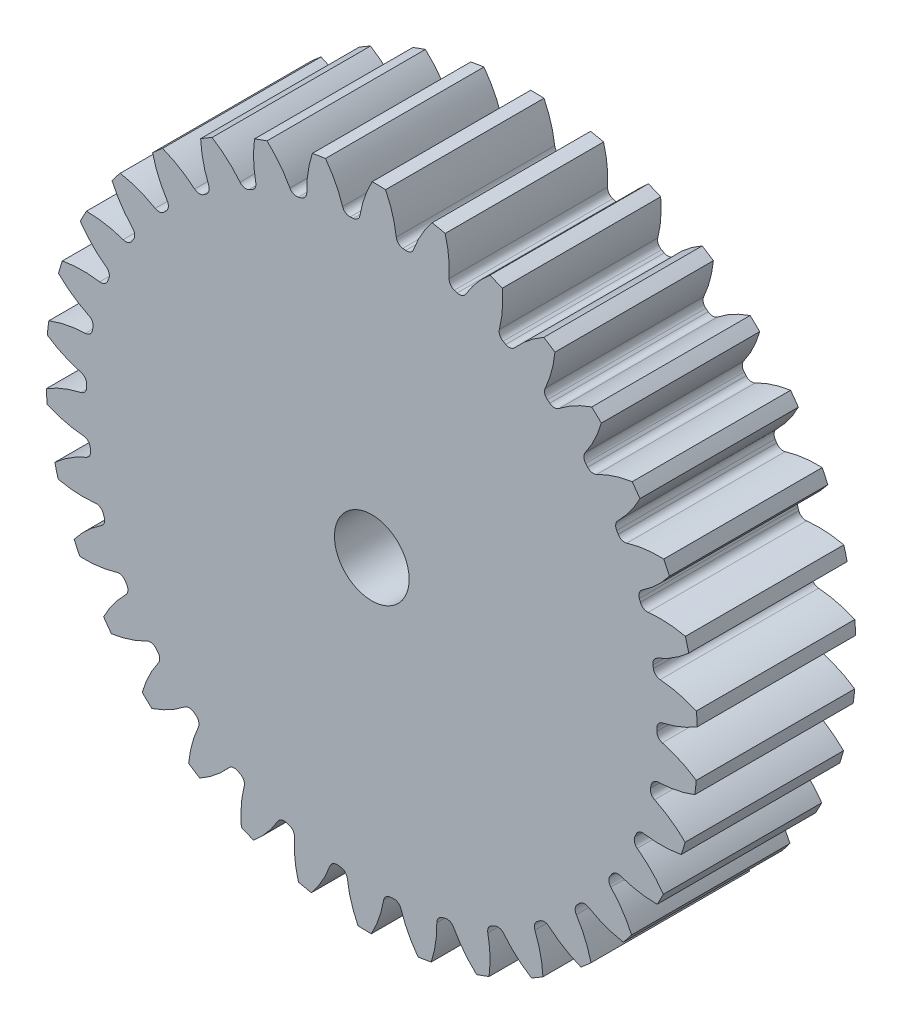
SolidWorks part; units mm, degrees
ref_plane "Front" through (0, 0, 0) normal (0, 0, 1) x (1, 0, 0)
ref_plane "Top" through (0, 0, 0) normal (0, 1, 0) x (1, 0, 0)
ref_plane "Right" through (0, 0, 0) normal (1, 0, 0) x (0, 0, -1)
sketch "Sketch3" plane through (0, 0, 0) normal (0, 0, 1) x (1, 0, 0)
  circle A0 centre (0, 0) radius 182.88
  dimension "od" = 365.76
extrude "gearBody" add sketch "Sketch3" along normal blind 88.9
sketch "Sketch2" plane through (0, 0, 0) normal (0, 0, 1) x (1, 0, 0)
  line L0 (0, 0) -> (149.9491, 62.1109) construction
  line L1 (182.2985, -17.2904) -> (0, 0) construction
  line L2 (0, 0) -> (36.3143, 0) construction
  line L3 (172.6695, 4.1759) -> (172.3221, -11.7178) construction
  line L5 (172.4958, -3.7709) -> (0, 0) construction
  line L7 (0, 0) -> (162.3037, 0) construction
  arc A0 (162.2999, 1.118) -> (162.0959, -8.2096) centre (0, 0) ccw construction
  arc A1 (182.6502, 9.1646) -> (182.0752, -17.1379) centre (0, 0) ccw construction
  arc A2 (172.6695, 4.1759) -> (172.3221, -11.7178) centre (0, 0) ccw construction
  arc A3 (159.9611, -4.3415) -> (159.998, -2.6532) centre (0, 0) ccw
  arc A4 (182.2985, -17.2904) -> (163.0353, -8.4508) centre (147.0915, -68.6046) ccw
  arc A5 (182.2985, -17.2904) -> (182.88, 9.3072) centre (0, 0) ccw
  arc A6 (182.88, 9.3072) -> (163.2488, 1.3178) centre (149.9491, 62.1109) cw
  arc A7 (159.998, -2.6532) -> (163.2488, 1.3178) centre (164.1326, -2.7217) cw
  arc A8 (163.0353, -8.4508) -> (159.9611, -4.3415) centre (164.0947, -4.4537) cw
  point P6 (182.88, 9.3072)
  point P22 (182.2985, -17.2904)
  dimension "baseDia" = 324.6074
  dimension "od" = 365.76
  dimension "pd" = 345.44
  dimension "rd" = 320.04
  dimension "rFillet" = 4.1351
  dimension "pointX" = 182.88
  dimension "pointY" = 9.3072
  dimension "CTT" = 15.8937
  dimension "flankCenterAngle" = 22.5
extrude "toothCut" cut sketch "Sketch2" along normal through all
pattern_circular "CirPattern1" count 34 over 360 about axis through (0, 0, 0) along (0, 0, 1) of "toothCut"
sketch "hub1Dia" plane through (0, 0, 0) normal (0, 0, -1) x (-1, 0, 0)
  circle A0 centre (0, 0) radius 12.7
  dimension "hub1Dia" = 25.4
sketch "hub2Dia" plane through (0, 0, 88.9) normal (0, 0, 1) x (1, 0, 0)
  circle A0 centre (0, 0) radius 12.7
  dimension "hub2dia" = 25.4
sketch "boreDia" plane through (0, 0, 0) normal (0, 0, 1) x (1, 0, 0)
  circle A0 centre (0, 0) radius 20.955
  dimension "boreDia" = 41.91
extrude "bore" cut sketch "boreDia" against normal mid plane 25400
